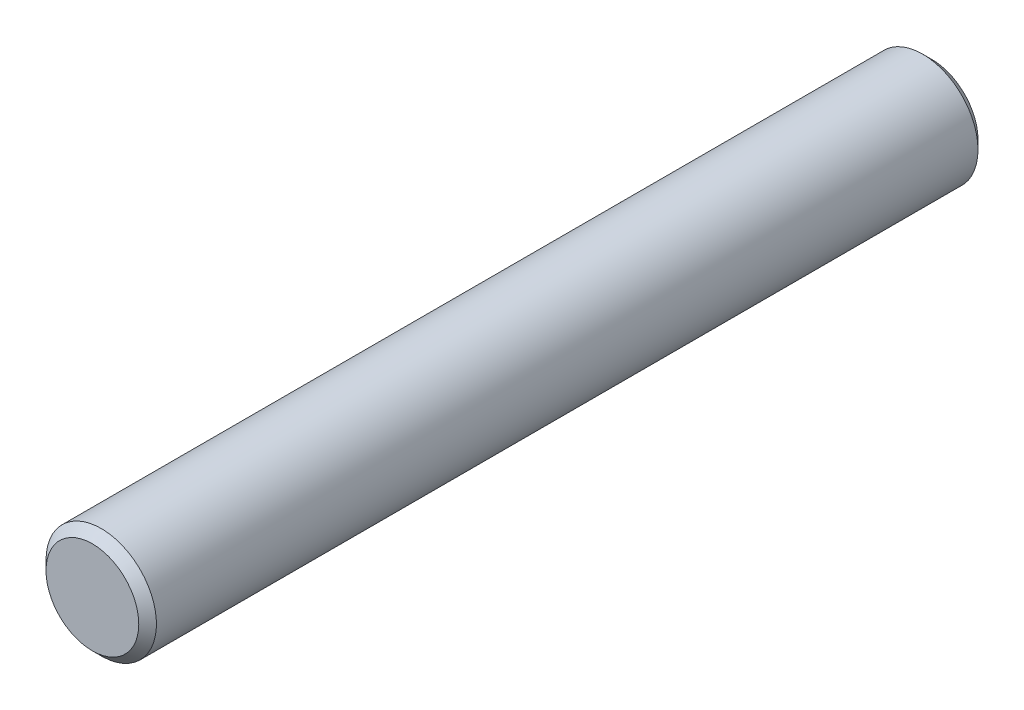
SolidWorks part; units mm, degrees
ref_plane "Front Plane" through (0, 0, 0) normal (0, 0, 1) x (1, 0, 0)
ref_plane "Top Plane" through (0, 0, 0) normal (0, 1, 0) x (1, 0, 0)
ref_plane "Right Plane" through (0, 0, 0) normal (1, 0, 0) x (0, 0, -1)
sketch "Sketch1" plane through (0, 0, 0) normal (0, 0, 1) x (1, 0, 0)
  circle A0 centre (0, 0) radius 1.5875
  dimension "D1" = 3.175
extrude "Extrude1" add sketch "Sketch1" along normal blind 24.13
chamfer "Chamfer1" distance 0.254 angle 45 2 edges at (1.5875, 0, 0) (1.5875, 0, 24.13)
